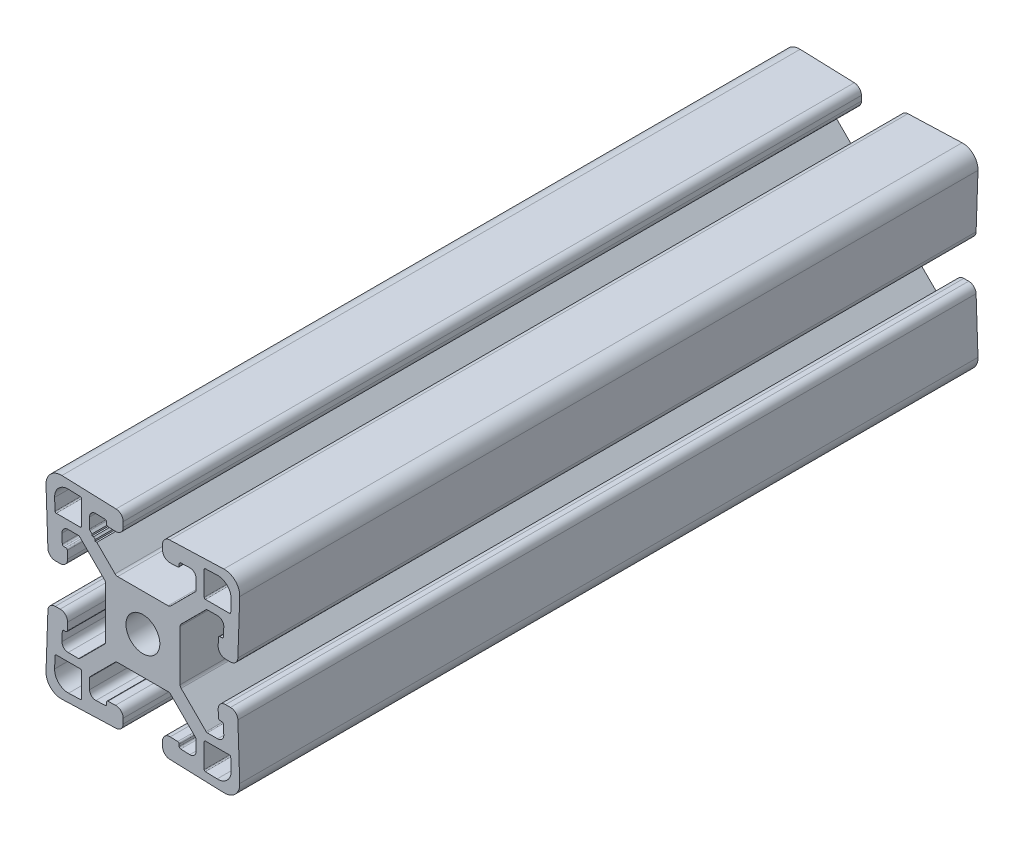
SolidWorks part; units mm, degrees
ref_plane "Front Plane" through (0, 0, 0) normal (0, 0, 1) x (1, 0, 0)
ref_plane "Top Plane" through (0, 0, 0) normal (0, 1, 0) x (1, 0, 0)
ref_plane "Right Plane" through (0, 0, 0) normal (1, 0, 0) x (0, 0, -1)
sketch "Sketch1" plane through (0, 0, 0) normal (0, 0, 1) x (1, 0, 0)
  line L0 (0, 0) -> (0, 20) construction
  line L1 (0, 0) -> (20, 0) construction
  line L2 (0, 0) -> (-20, 20) construction
  line L3 (-16.7142, 19.9981) -> (-5.5358, 19.6077)
  line L4 (-20, 20) -> (0, 20) construction
  line L5 (-4.064, 18.0836) -> (-4.064, 17.069)
  line L6 (-5.6422, 15.5449) -> (-7.1936, 15.5991)
  line L7 (-7.5, 15.9164) -> (-7.5, 16.3198)
  line L8 (-7.8064, 16.6371) -> (-9.6857, 16.7028)
  line L9 (-11, 15.4335) -> (-11, 13.2868)
  line L10 (0, 7.681) -> (-5.2101, 7.681)
  line L11 (-5.7489, 7.9042) -> (-10.907, 13.0623)
  line L12 (-7.9042, 5.7489) -> (-13.0623, 10.907)
  line L13 (-7.681, 0) -> (-7.681, 5.2101)
  line L14 (-15.4335, 11) -> (-13.2868, 11)
  line L15 (-16.6371, 7.8064) -> (-16.7028, 9.6857)
  line L16 (-15.9164, 7.5) -> (-16.3198, 7.5)
  line L17 (-15.5449, 5.6422) -> (-15.5991, 7.1936)
  line L18 (-18.0836, 4.064) -> (-17.069, 4.064)
  line L19 (-19.9981, 16.7142) -> (-19.6077, 5.5358)
  line L20 (-18.2207, 15.3309) -> (-18.1275, 12.661)
  line L21 (-15.3309, 18.2207) -> (-12.661, 18.1275)
  line L22 (-18.1275, 12.661) -> (-12.661, 12.661)
  line L23 (-12.661, 18.1275) -> (-12.661, 12.661)
  line L24 (0, 0) -> (-20, 0) construction
  line L25 (-20, 0) -> (0, 0) construction
  line L26 (0, 0) -> (0, -20) construction
  line L27 (-20, -20) -> (-20, 20) construction
  line L28 (0, 20) -> (20, 20) construction
  line L30 (-20, -20) -> (20, -20) construction
  arc A0 (-19.9981, 16.7142) -> (-16.7142, 19.9981) centre (-16.825, 16.825) cw
  arc A1 (-7.1936, 15.5991) -> (-7.5, 15.9164) centre (-7.1825, 15.9164) cw
  arc A2 (-7.5, 16.3198) -> (-7.8064, 16.6371) centre (-7.8175, 16.3198) ccw
  arc A3 (-9.6857, 16.7028) -> (-11, 15.4335) centre (-9.73, 15.4335) ccw
  arc A4 (-4.064, 17.069) -> (-5.6422, 15.5449) centre (-5.589, 17.069) cw
  arc A5 (-5.5358, 19.6077) -> (-4.064, 18.0836) centre (-5.589, 18.0836) cw
  arc A6 (-5.2101, 7.681) -> (-5.7489, 7.9042) centre (-5.2101, 8.443) cw
  arc A7 (-7.9042, 5.7489) -> (-7.681, 5.2101) centre (-8.443, 5.2101) cw
  arc A8 (-11, 13.2868) -> (-10.907, 13.0623) centre (-10.6825, 13.2868) ccw
  arc A9 (-18.0836, 4.064) -> (-19.6077, 5.5358) centre (-18.0836, 5.589) cw
  arc A10 (-15.5449, 5.6422) -> (-17.069, 4.064) centre (-17.069, 5.589) cw
  arc A11 (-15.9164, 7.5) -> (-15.5991, 7.1936) centre (-15.9164, 7.1825) cw
  arc A12 (-16.6371, 7.8064) -> (-16.3198, 7.5) centre (-16.3198, 7.8175) ccw
  arc A13 (-15.4335, 11) -> (-16.7028, 9.6857) centre (-15.4335, 9.73) ccw
  arc A14 (-13.0623, 10.907) -> (-13.2868, 11) centre (-13.2868, 10.6825) ccw
  arc A15 (-15.3309, 18.2207) -> (-18.2207, 15.3309) centre (-15.4284, 15.4284) ccw
  circle A16 centre (0, 0) radius 3.5
  point P26 (-7.5, 15.6098)
  point P29 (-7.5, 16.6264)
  point P32 (-11, 16.7487)
  point P35 (-4.064, 15.4898)
  point P38 (-4.064, 19.5563)
  point P42 (-5.5257, 7.681)
  point P45 (-7.681, 5.5257)
  point P48 (-11, 13.1553)
  point P51 (-19.5563, 4.064)
  point P54 (-15.4898, 4.064)
  point P57 (-15.6098, 7.5)
  point P60 (-16.6264, 7.5)
  point P63 (-16.7487, 11)
  point P66 (-13.1553, 11)
  point P80 (-20, 0)
  point P85 (0, -20)
  point P88 (0, -20)
sketch "Sketch2" plane through (0, 0, 0) normal (1, 0, 0) x (0, 0, -1)
  line L0 (-76.2, 0) -> (76.2, 0)
  line L1 (-76.2, -20) -> (-76.2, 20) construction
  line L2 (0, 0) -> (0, 20) construction
  line L3 (0, 0) -> (0, 20) construction
  line L4 (76.2, -20) -> (76.2, 20) construction
  point P0 (-16.2, 0)
  point P3 (0, 0)
  point P7 (16.2, 0)
  point P11 (-76.2, 0)
  point P14 (76.2, 0)
sketch "Sketch3" plane through (0, 0, 0) normal (0, 0, 1) x (1, 0, 0)
  line L0 (-7.681, 0) -> (-7.681, 5.2101) construction
  line L1 (-7.9042, 5.7489) -> (-13.0623, 10.907) construction
  line L2 (-15.4335, 11) -> (-13.2868, 11) construction
  line L3 (-16.6371, 7.8064) -> (-16.7028, 9.6857) construction
  line L4 (-18.2207, 15.3309) -> (-18.1275, 12.661)
  line L5 (-18.1275, 12.661) -> (-12.661, 12.661)
  line L6 (-12.661, 12.661) -> (-12.661, 18.1275)
  line L7 (-12.661, 18.1275) -> (-15.3309, 18.2207)
  line L8 (-18.2207, 15.3309) -> (-18.136, 12.9061)
  line L9 (-17.8822, 12.661) -> (-12.915, 12.661)
  line L10 (-12.661, 12.915) -> (-12.661, 17.8822)
  line L11 (-12.9061, 18.136) -> (-15.3309, 18.2207)
  line L12 (-15.9164, 7.5) -> (-16.3198, 7.5) construction
  line L13 (-15.5449, 5.6422) -> (-15.5991, 7.1936) construction
  line L14 (-18.0836, 4.064) -> (-17.069, 4.064) construction
  line L15 (-19.9981, 16.7142) -> (-19.6077, 5.5358) construction
  line L16 (-16.7142, 19.9981) -> (-5.5358, 19.6077) construction
  line L17 (-4.064, 18.0836) -> (-4.064, 17.069) construction
  line L18 (-5.6422, 15.5449) -> (-7.1936, 15.5991) construction
  line L19 (-7.5, 15.9164) -> (-7.5, 16.3198) construction
  line L20 (-7.8064, 16.6371) -> (-9.6857, 16.7028) construction
  line L21 (-11, 15.4335) -> (-11, 13.2868) construction
  line L22 (-5.7489, 7.9042) -> (-10.907, 13.0623) construction
  line L23 (0, 7.681) -> (-5.2101, 7.681) construction
  line L24 (-7.681, 0) -> (-7.681, 5.2101)
  line L25 (-7.9042, 5.7489) -> (-13.0623, 10.907)
  line L26 (-15.4335, 11) -> (-13.2868, 11)
  line L27 (-16.6371, 7.8064) -> (-16.7028, 9.6857)
  line L28 (-15.9164, 7.5) -> (-16.3198, 7.5)
  line L29 (-15.5449, 5.6422) -> (-15.5991, 7.1936)
  line L30 (-18.0836, 4.064) -> (-17.069, 4.064)
  line L31 (-19.9981, 16.7142) -> (-19.6077, 5.5358)
  line L32 (-16.7142, 19.9981) -> (-5.5358, 19.6077)
  line L33 (-4.064, 18.0836) -> (-4.064, 17.069)
  line L34 (-5.6422, 15.5449) -> (-7.1936, 15.5991)
  line L35 (-7.5, 15.9164) -> (-7.5, 16.3198)
  line L36 (-7.8064, 16.6371) -> (-9.6857, 16.7028)
  line L37 (-11, 15.4335) -> (-11, 13.2868)
  line L38 (-5.7489, 7.9042) -> (-10.907, 13.0623)
  line L39 (0, 7.681) -> (-5.2101, 7.681)
  line L40 (-7.681, 0) -> (-3.5, 0)
  line L41 (0, 3.5) -> (0, 7.681)
  arc A0 (-7.681, 5.2101) -> (-7.9042, 5.7489) centre (-8.443, 5.2101) ccw construction
  circle A1 centre (0, 0) radius 3.5
  arc A2 (0, 3.5) -> (-3.5, 0) centre (0, 0) ccw
  arc A3 (-15.3309, 18.2207) -> (-18.2207, 15.3309) centre (-15.4284, 15.4284) ccw
  arc A4 (-15.3309, 18.2207) -> (-18.2207, 15.3309) centre (-15.4284, 15.4284) ccw
  arc A5 (-13.0623, 10.907) -> (-13.2868, 11) centre (-13.2868, 10.6825) ccw construction
  arc A6 (-15.4335, 11) -> (-16.7028, 9.6857) centre (-15.4335, 9.73) ccw construction
  arc A7 (-16.6371, 7.8064) -> (-16.3198, 7.5) centre (-16.3198, 7.8175) ccw construction
  arc A8 (-15.5991, 7.1936) -> (-15.9164, 7.5) centre (-15.9164, 7.1825) ccw construction
  arc A9 (-17.069, 4.064) -> (-15.5449, 5.6422) centre (-17.069, 5.589) ccw construction
  arc A10 (-19.6077, 5.5358) -> (-18.0836, 4.064) centre (-18.0836, 5.589) ccw construction
  arc A11 (-16.7142, 19.9981) -> (-19.9981, 16.7142) centre (-16.825, 16.825) ccw construction
  arc A12 (-4.064, 18.0836) -> (-5.5358, 19.6077) centre (-5.589, 18.0836) ccw construction
  arc A13 (-5.6422, 15.5449) -> (-4.064, 17.069) centre (-5.589, 17.069) ccw construction
  arc A14 (-7.5, 15.9164) -> (-7.1936, 15.5991) centre (-7.1825, 15.9164) ccw construction
  arc A15 (-7.5, 16.3198) -> (-7.8064, 16.6371) centre (-7.8175, 16.3198) ccw construction
  arc A16 (-9.6857, 16.7028) -> (-11, 15.4335) centre (-9.73, 15.4335) ccw construction
  arc A17 (-11, 13.2868) -> (-10.907, 13.0623) centre (-10.6825, 13.2868) ccw construction
  arc A18 (-5.7489, 7.9042) -> (-5.2101, 7.681) centre (-5.2101, 8.443) ccw construction
  arc A19 (-7.681, 5.2101) -> (-7.9042, 5.7489) centre (-8.443, 5.2101) ccw
  arc A20 (-13.0623, 10.907) -> (-13.2868, 11) centre (-13.2868, 10.6825) ccw
  arc A21 (-15.4335, 11) -> (-16.7028, 9.6857) centre (-15.4335, 9.73) ccw
  arc A22 (-16.6371, 7.8064) -> (-16.3198, 7.5) centre (-16.3198, 7.8175) ccw
  arc A23 (-15.5991, 7.1936) -> (-15.9164, 7.5) centre (-15.9164, 7.1825) ccw
  arc A24 (-17.069, 4.064) -> (-15.5449, 5.6422) centre (-17.069, 5.589) ccw
  arc A25 (-19.6077, 5.5358) -> (-18.0836, 4.064) centre (-18.0836, 5.589) ccw
  arc A26 (-16.7142, 19.9981) -> (-19.9981, 16.7142) centre (-16.825, 16.825) ccw
  arc A27 (-4.064, 18.0836) -> (-5.5358, 19.6077) centre (-5.589, 18.0836) ccw
  arc A28 (-5.6422, 15.5449) -> (-4.064, 17.069) centre (-5.589, 17.069) ccw
  arc A29 (-7.5, 15.9164) -> (-7.1936, 15.5991) centre (-7.1825, 15.9164) ccw
  arc A30 (-7.5, 16.3198) -> (-7.8064, 16.6371) centre (-7.8175, 16.3198) ccw
  arc A31 (-9.6857, 16.7028) -> (-11, 15.4335) centre (-9.73, 15.4335) ccw
  arc A32 (-11, 13.2868) -> (-10.907, 13.0623) centre (-10.6825, 13.2868) ccw
  arc A33 (-5.7489, 7.9042) -> (-5.2101, 7.681) centre (-5.2101, 8.443) ccw
  arc A36 (-12.661, 17.8822) -> (-12.9061, 18.136) centre (-12.915, 17.8822) ccw
  arc A37 (-12.915, 12.661) -> (-12.661, 12.915) centre (-12.915, 12.915) ccw
  arc A38 (-18.136, 12.9061) -> (-17.8822, 12.661) centre (-17.8822, 12.915) ccw
  dimension "D3" = 0.254
  dimension "D1" = 0
  dimension "D2" = 0
extrude "Boss-Extrude1" add sketch "Sketch3" along normal mid plane 152.4
pattern_circular "CirPattern1" count 4 over 360 about axis through (0, 0, 0) along (0, 0, 1) of "Boss-Extrude1"
sketch "Sketch4" plane through (0, 0, 0) normal (0, 0, 1) x (1, 0, 0)
  line L1 (-10.5057, 12.661) -> (-9.5057, 12.661)
  line L8 (-5.7489, 7.9042) -> (-10.907, 13.0623) construction
  line L9 (-9.5057, 12.661) -> (-9.5057, 11.661)
  line L10 (-9.5057, 11.661) -> (-9.8391, 11.661)
  line L12 (-10.1724, 12.3277) -> (-9.8391, 11.9943)
  line L20 (-9.8391, 11.9943) -> (-9.8391, 12.3277) construction
  line L22 (-9.8391, 11.661) -> (-9.8391, 11.9943)
  line L23 (-9.8391, 12.3277) -> (-10.1724, 12.3277) construction
  line L25 (-10.1724, 12.3277) -> (-10.5057, 12.3277)
  line L26 (-10.5057, 12.3277) -> (-10.5057, 12.661)
  line L27 (-17.8822, 12.661) -> (-12.915, 12.661) construction
  dimension "D2" = 1
extrude "Cut-Extrude1" cut sketch "Sketch4" against normal through all both and the other way through all
ref_plane "Contact Plane 1" through (0, 20, 0) normal (0, 1, 0) x (1, 0, 0)
ref_plane "Contact Plane 2" through (20, 0, 0) normal (1, 0, 0) x (0, 0, -1)
ref_plane "Contact Plane 3" through (0, -20, 0) normal (0, -1, 0) x (-1, 0, 0)
ref_plane "Contact Plane 4" through (-20, 0, 0) normal (-1, 0, 0) x (0, 0, 1)
equation "\"D1@Sketch2\"=\"Rail Width@Sketch1\"*1.5"
equation "\"D1@Boss-Extrude1\"=\"Length@Sketch2\""
equation "\"ShaftDiameter\"= 12mm"
equation "\"PendulumDiameter\"=12mm"
equation "\"PendulumLength\"= 140mm"
equation "\"EncoderOuterDiameter\"=1.5"
equation "\"EncoderShaftDiameter\"= 6mm"
equation "\"EncoderShaftLength\"=15mm+.5in+3mm"
equation "\"PendulumHolderangle\"=60"
equation "\"PendulumholderBottomHeight\"= 75"
equation "\"PendulumholderBottomWidth\"= 75"
equation "\"PendulumholderHeight\"=25"
equation "\"BearingOutsideDiameter\"=21mm"
equation "\"PendulumHolderWidth\"= 100mm"
equation "\"ShaftHeightFromTSlot\"= 100mm"
equation "\"BearingThickness\"= 5mm"
equation "\"SlipRingOuterDiameter\"=56mm"
equation "\"SlipringBigThickness\"=25mm"
equation "\"SlipringSmallThickness\"=8.5mm"
equation "\"Tol\"=2mm"
equation "\"ScrewHole\"= 5mm"
equation "\"Tframwidth\"= 40mm"
equation "\"TFrameheight\"= 12in"
equation "\"Tframetotalwidth\"= 2ft"
equation "\"TFramethickness\"= 6in"
equation "\"Length@Sketch2\"=\"TFramethickness\""
